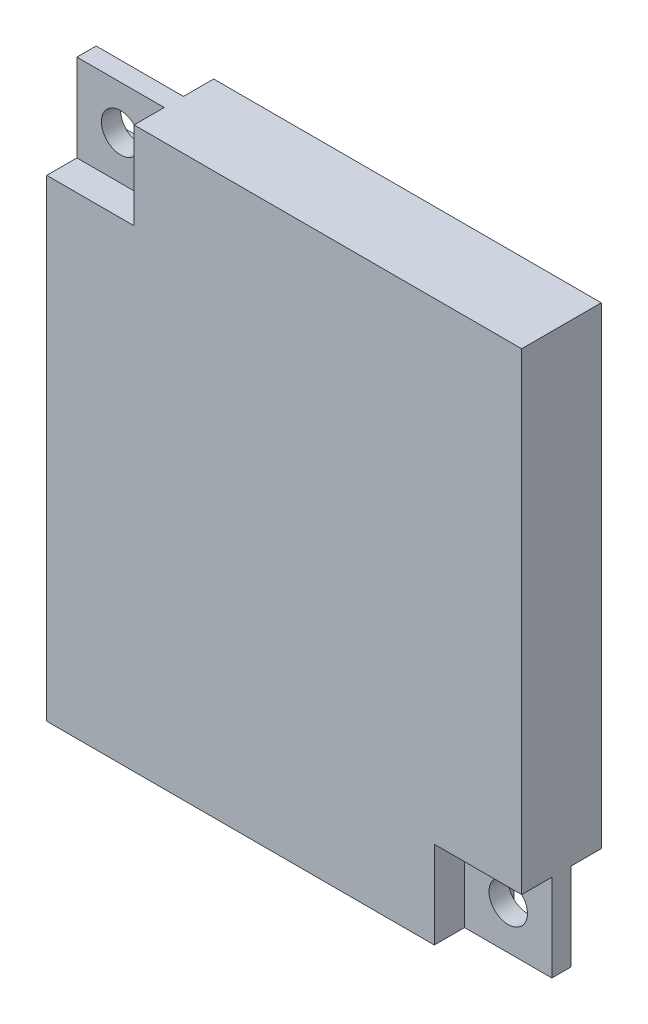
SolidWorks part; units mm, degrees
ref_plane "Front Plane" through (0, 0, 0) normal (0, 0, 1) x (1, 0, 0)
ref_plane "Top Plane" through (0, 0, 0) normal (0, 1, 0) x (1, 0, 0)
ref_plane "Right Plane" through (0, 0, 0) normal (1, 0, 0) x (0, 0, -1)
sketch "Sketch1" plane through (0, 0, 0) normal (0, 0, 1) x (1, 0, 0)
  line L1 (0, 0) -> (-21.971, 0)
  line L2 (0, 0) -> (0, 25.908)
  line L3 (0, 25.908) -> (-21.971, 25.908)
  line L4 (-21.971, 0) -> (-21.971, 25.908)
  dimension "D1" = 21.971
  dimension "D2" = 25.908
extrude "Extrude1" add sketch "Sketch1" along normal blind 0.889
sketch "Sketch2" plane through (0, 0, 0.889) normal (0, 0, 1) x (1, 0, 0)
  line L0 (-17.9324, 25.908) -> (-17.9324, 21.8694)
  line L1 (0, 25.908) -> (-21.971, 25.908) construction
  line L2 (-17.9324, 21.8694) -> (-21.971, 21.8694)
  line L3 (-21.971, 25.908) -> (-21.971, 0) construction
  line L4 (-21.971, 21.8694) -> (-21.971, 0)
  line L5 (-21.971, 0) -> (-4.0386, 0)
  line L6 (-21.971, 0) -> (0, 0) construction
  line L7 (-4.0386, 0) -> (-4.0386, 4.0386)
  line L8 (-4.0386, 4.0386) -> (0, 4.0386)
  line L9 (0, 0) -> (0, 25.908) construction
  line L10 (0, 4.0386) -> (0, 25.908)
  line L11 (0, 25.908) -> (-17.9324, 25.908)
  dimension "D1" = 4.0386
  dimension "D2" = 4.0386
  dimension "D3" = 4.0386
  dimension "D4" = 4.0386
extrude "Extrude2" add sketch "Sketch2" along normal blind 1.397
sketch "Sketch3" plane through (0, 0, 0) normal (0, 0, -1) x (-1, 0, 0)
  line L0 (4.0386, 0) -> (4.0386, 4.0386)
  line L1 (4.0386, 4.0386) -> (0, 4.0386)
  line L2 (0, 4.0386) -> (0, 25.908)
  line L3 (0, 25.908) -> (17.9324, 25.908)
  line L4 (17.9324, 25.908) -> (17.9324, 21.8694)
  line L5 (17.9324, 21.8694) -> (21.971, 21.8694)
  line L6 (21.971, 21.8694) -> (21.971, 10.5156)
  line L7 (21.971, 25.908) -> (21.971, 0) construction
  line L8 (21.971, 10.5156) -> (17.78, 10.5156)
  line L9 (17.78, 10.5156) -> (17.78, 0)
  line L10 (21.971, 0) -> (0, 0) construction
  line L11 (17.78, 0) -> (4.0386, 0)
  dimension "D1" = 4.191
  dimension "D2" = 10.5156
extrude "Extrude3" add sketch "Sketch3" along normal blind 1.397
sketch "Sketch4" plane through (0, 0, 0.889) normal (0, 0, 1) x (1, 0, 0)
  line L0 (-17.9324, 23.8887) -> (-21.971, 23.8887) construction
  line L1 (-17.9324, 25.908) -> (-17.9324, 21.8694) construction
  line L2 (-21.971, 25.908) -> (-21.971, 21.8694) construction
  line L3 (0, 2.0193) -> (-4.0386, 2.0193) construction
  line L4 (0, 0) -> (0, 4.0386) construction
  line L5 (-4.0386, 0) -> (-4.0386, 4.0386) construction
  circle A0 centre (-19.9517, 23.8887) radius 0.889
  circle A1 centre (-2.0193, 2.0193) radius 0.889
  dimension "D1" = 1.778
  dimension "D2" = 1.778
extrude "Cut-Extrude1" cut sketch "Sketch4" against normal through all
sketch "Sketch6" plane through (0, 0, 0) normal (0, 0, -1) x (-1, 0, 0)
  line L0 (21.971, 0) -> (17.78, 0) construction
  line L1 (21.336, 2.032) -> (18.3134, 2.032)
  line L2 (21.336, 2.032) -> (21.336, 10.033)
  line L3 (21.336, 10.033) -> (18.3134, 10.033)
  line L4 (18.3134, 2.032) -> (18.3134, 10.033)
  line L5 (21.971, 10.5156) -> (21.971, 0) construction
  dimension "D1" = 8.001
  dimension "D2" = 3.0226
  dimension "D3" = 2.032
  dimension "D4" = 0.635
extrude "Extrude4" add sketch "Sketch6" along normal blind 4.318
